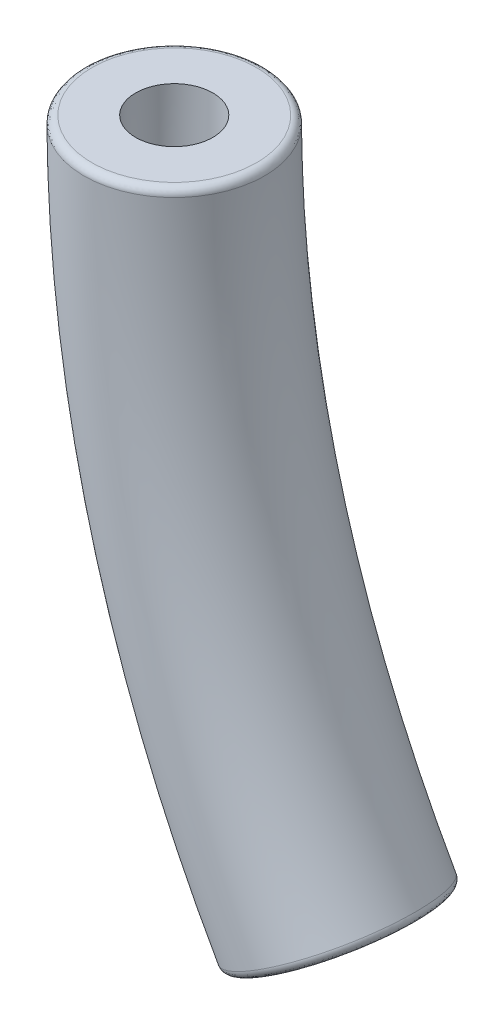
SolidWorks part; units mm, degrees
ref_plane "Plan de face" through (0, 0, 0) normal (0, 0, 1) x (1, 0, 0)
ref_plane "Plan de dessus" through (0, 0, 0) normal (0, 1, 0) x (1, 0, 0)
ref_plane "Plan de droite" through (0, 0, 0) normal (1, 0, 0) x (0, 0, -1)
sketch "Esquisse2" plane through (0, 0, 0) normal (0, 0, 1) x (1, 0, 0)
  line L3 (-585.8003, 0) -> (0, 0) construction
  line L4 (0, 0) -> (-417.166, -241.4468) construction
  line L5 (0, 0) -> (-465.5094, -125) construction
  line L6 (-465.5094, -125) -> (-645.5068, -173.3334) construction
  arc A0 (-482, 0) -> (-417.166, -241.4468) centre (0, 0) ccw
  dimension "D1" = 482
  dimension "D2" = 250
ref_plane "Plan1" through (-482, 0, 0) normal (0, -1, 0) x (1, 0, 0)
sketch "Esquisse3" plane through (-482, 0, 0) normal (0, -1, 0) x (1, 0, 0)
  line L0 (-103.8003, 0) -> (482, 0) construction
  circle A0 centre (0, 0) radius 35
  circle A1 centre (0, 0) radius 15
  dimension "D1" = 70
  dimension "D3" = 30
  dimension "D2" = 482
sketch "Esquisse4" plane through (0, 0, 0) normal (0, 0, 1) x (1, 0, 0)
  line L0 (0, 0) -> (-369.0332, -310.0621) construction
  arc A0 (-482, 0) -> (-417.166, -241.4468) centre (0, 0) ccw construction
  dimension "D1" = 330
sweep "Balayage1" add profiles "Esquisse3" path "Esquisse2"
fillet "Congé1" radius 3 2 edges at (-447, 0, 0) (-386.8738, -223.9143, 0)
